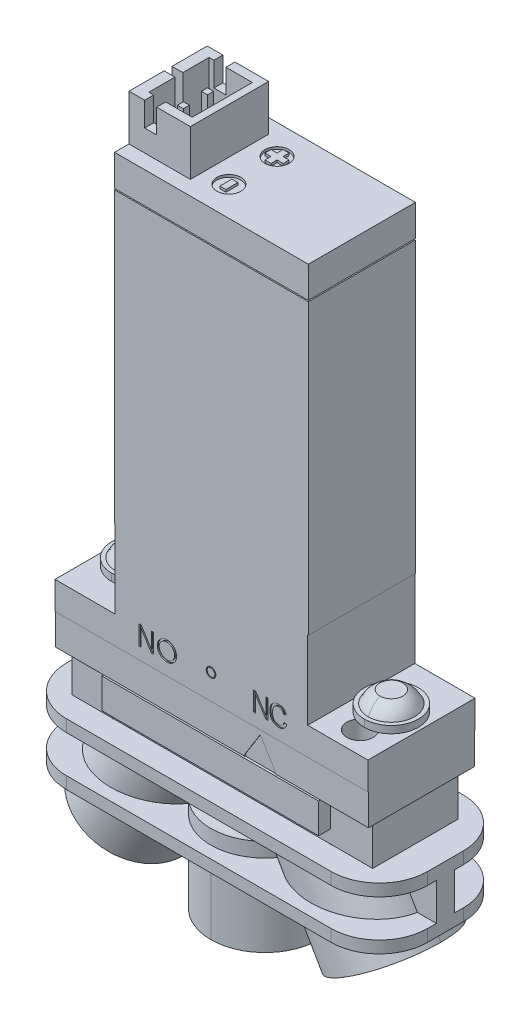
SolidWorks part; units mm, degrees
ref_plane "Front Plane" through (0, 0, 0) normal (0, 0, 1) x (1, 0, 0)
ref_plane "Top Plane" through (0, 0, 0) normal (0, 1, 0) x (1, 0, 0)
ref_plane "Right Plane" through (0, 0, 0) normal (1, 0, 0) x (0, 0, -1)
imported_body "6724_295793_2_2__and_3_2_way_Rocker_Solenoid_Valve_with_medium_separation.sldprt"
sketch "Sketch3" plane through (0, -11.3, 0) normal (0, -1, 0) x (1, 0, 0)
  line L0 (-23, -5.5) -> (23, -5.5) construction
  line L1 (-11, -5.5) -> (11, -5.5)
  line L2 (-15, -1.5) -> (-15, 1.5)
  line L3 (-11, 5.5) -> (11, 5.5)
  line L4 (15, -1.5) -> (15, 1.5)
  line L5 (-23, 5.5) -> (23, 5.5) construction
  line L6 (-23, 5.5) -> (-23, -5.5) construction
  line L7 (23, 5.5) -> (23, -5.5) construction
  arc A0 (11, 5.5) -> (15, 1.5) centre (11, 1.5) cw
  arc A1 (11, -5.5) -> (15, -1.5) centre (11, -1.5) ccw
  arc A2 (-15, 1.5) -> (-11, 5.5) centre (-11, 1.5) cw
  arc A3 (-11, -5.5) -> (-15, -1.5) centre (-11, -1.5) cw
  point P10 (15, 5.5)
  point P17 (-15, -5.5)
  dimension "D1" = 4
  dimension "D2" = 8
  dimension "D3" = 8
extrude "Cut-Extrude3" cut sketch "Sketch3" against normal blind 7 flip side to cut
